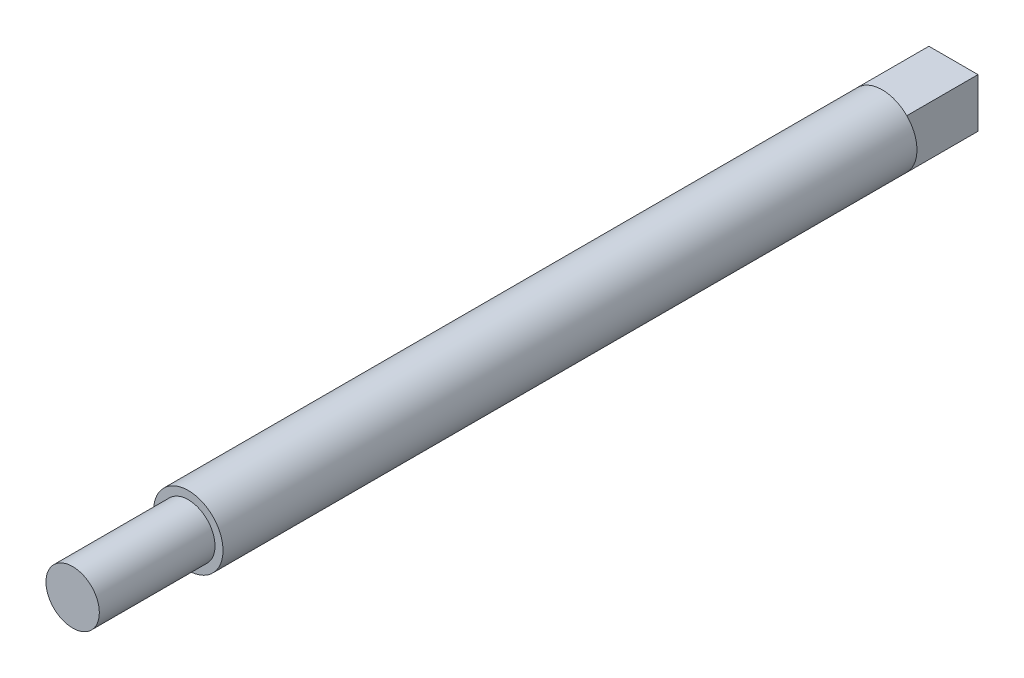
SolidWorks part; units mm, degrees
ref_plane "Plan de face" through (0, 0, 0) normal (0, 0, 1) x (1, 0, 0)
ref_plane "Plan de dessus" through (0, 0, 0) normal (0, 1, 0) x (1, 0, 0)
ref_plane "Plan de droite" through (0, 0, 0) normal (1, 0, 0) x (0, 0, -1)
sketch "Esquisse1" plane through (0, 0, 0) normal (0, 0, 1) x (1, 0, 0)
  circle A0 centre (0, 0) radius 1.95
  dimension "D1" = 3.9
extrude "Boss.-Extru.1" add sketch "Esquisse1" along normal blind 45.5
sketch "Esquisse3" plane through (0, 0, 45.5) normal (0, 0, 1) x (1, 0, 0)
  circle A0 centre (0, 0) radius 1.5
  dimension "D1" = 3
extrude "Enlèv. mat.-Extru.2" cut sketch "Esquisse3" against normal blind 6.5 flip side to cut
sketch "Esquisse4" plane through (0, 0, 0) normal (0, 0, -1) x (-1, 0, 0)
  line L1 (-1.38, 1.38) -> (1.38, 1.38)
  line L2 (-1.38, 1.38) -> (-1.38, -1.38)
  line L3 (-1.38, -1.38) -> (1.38, -1.38)
  line L4 (1.38, 1.38) -> (1.38, -1.38)
  line L5 (-1.38, 1.38) -> (1.38, -1.38) construction
  line L6 (-1.38, -1.38) -> (1.38, 1.38) construction
  point P0 (0, 0)
  dimension "D1" = 2.76
  dimension "D2" = 2.76
extrude "Boss.-Extru.2" add sketch "Esquisse4" along normal blind 4
